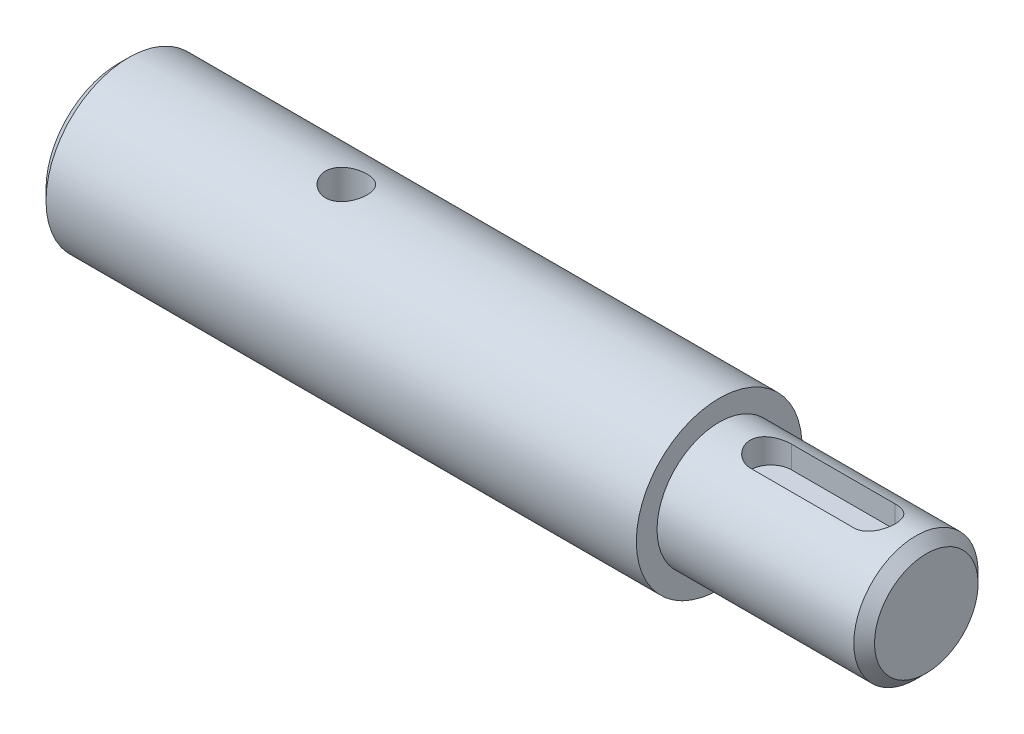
SolidWorks part; units mm, degrees
ref_plane "前视" through (0, 0, 0) normal (0, 0, 1) x (1, 0, 0)
ref_plane "上视" through (0, 0, 0) normal (0, 1, 0) x (1, 0, 0)
ref_plane "右视" through (0, 0, 0) normal (1, 0, 0) x (0, 0, -1)
sketch "草图1" plane through (0, 0, 0) normal (0, 0, 1) x (1, 0, 0)
  line L0 (0, 0) -> (115.0141, 0) construction
  line L1 (0, 0) -> (0, 7)
  line L2 (1, 8) -> (58, 8)
  line L3 (58, 8) -> (58, 6)
  line L4 (58, 6) -> (77, 6)
  line L5 (78, 5) -> (78, 0)
  line L6 (78, 0) -> (0, 0)
  line L7 (77, 6) -> (78, 5)
  line L8 (0, 7) -> (1, 8)
  point P3 (0, 8)
  point P6 (78, 6)
  dimension "D1" = 16
  dimension "D2" = 12
  dimension "D3" = 58
  dimension "D4" = 78
  dimension "D7" = 1
  dimension "D8" = 1
revolve "旋转1" add sketch "草图1" angle 360 about L0
ref_plane "基准面1" through (0, 3.5, 0) normal (0, 1, 0) x (-1, 0, 0)
sketch "草图2" plane through (0, 3.5, 0) normal (0, 1, 0) x (-1, 0, 0)
  line L0 (0, 0) -> (-24.1858, 0) construction
  line L1 (0, 0) -> (-115.0141, 0) construction
  line L2 (-63, -2) -> (-73, -2)
  line L3 (-63, 2) -> (-73, 2)
  line L4 (-58, 8) -> (-58, -8) construction
  arc A0 (-73, -2) -> (-73, 2) centre (-73, 0) cw
  arc A1 (-63, -2) -> (-63, 2) centre (-63, 0) ccw
  dimension "D1" = 14
  dimension "D2" = 3
  dimension "D3" = 4
extrude "切除-拉伸1" cut sketch "草图2" along normal through all
ref_plane "基准面2" through (22, 0, 0) normal (-1, 0, 0) x (0, 0, 1)
sketch "草图3" plane through (22, 0, 0) normal (-1, 0, 0) x (0, 0, 1)
  line L0 (0, 0) -> (0, 0.5462) construction
  line L1 (0, 9.0345) -> (0, 5.931) construction
  line L2 (0, 0) -> (0, 9.4147) construction
  line L3 (0, 8.6598) -> (-2, 8.6598)
  line L4 (-2, 8.6598) -> (-2, -0.8453)
  line L5 (-2, -0.8453) -> (0, -2)
  line L6 (0, -2) -> (0, 8.6598)
  dimension "D1" = 60
  dimension "D2" = 4
  dimension "D3" = 2
revolve "切除-旋转1" cut sketch "草图3" angle 360 about L2
